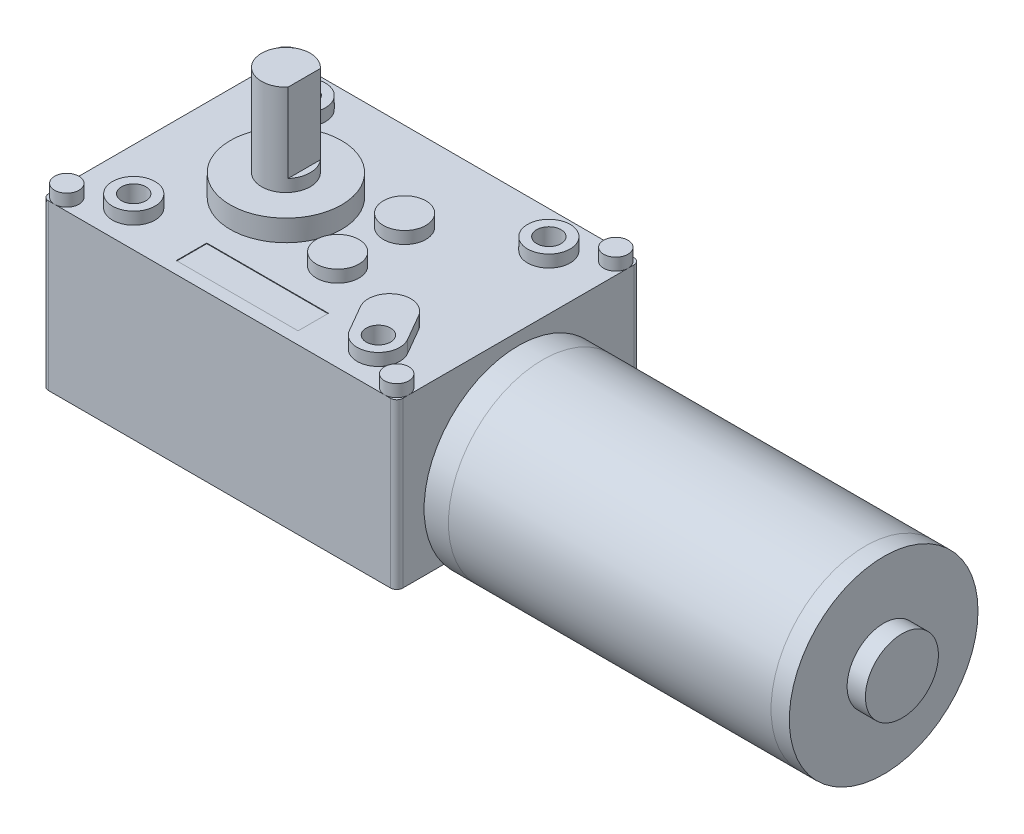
SolidWorks part; units mm, degrees
ref_plane "Front Plane" through (0, 0, 0) normal (0, 0, 1) x (1, 0, 0)
ref_plane "Top Plane" through (0, 0, 0) normal (0, 1, 0) x (1, 0, 0)
ref_plane "Right Plane" through (0, 0, 0) normal (1, 0, 0) x (0, 0, -1)
sketch "Sketch1" plane through (0, 0, 0) normal (0, 1, 0) x (1, 0, 0)
  line L1 (0, 0) -> (58.2, 0)
  line L2 (0, 0) -> (0, 40)
  line L3 (0, 40) -> (58.2, 40)
  line L4 (58.2, 0) -> (58.2, 40)
  dimension "D1" = 40
  dimension "D2" = 58.2
extrude "Boss-Extrude1" add sketch "Sketch1" along normal mid plane 27
sketch "Sketch2" plane through (0, 13.5, 0) normal (0, 1, 0) x (1, 0, 0)
  line L0 (58.2, 40) -> (0, 40) construction
  line L1 (0, 40) -> (0, 0) construction
  circle A0 centre (2, 38) radius 2
  circle A1 centre (56.2, 38) radius 2
  circle A2 centre (56.2, 2) radius 2
  circle A3 centre (2, 2) radius 2
  dimension "D1" = 4
  dimension "D2" = 2
  dimension "D3" = 2
  dimension "D6" = 2
  dimension "D7" = 2
  dimension "D4" = 2
  dimension "D5" = 2
extrude "Boss-Extrude2" add sketch "Sketch2" along normal blind 2
sketch "Sketch3" plane through (0, 0, 0) normal (0, 1, 0) x (1, 0, 0)
  line L0 (49.2, 6) -> (46.7, 10.3301) construction
  line L1 (49.2, 6) -> (47.3947, 6) construction
  line L2 (49.7311, 12.0801) -> (52.2311, 7.75)
  line L3 (43.6689, 8.5801) -> (46.1689, 4.25)
  line L4 (46.1689, 4.25) -> (52.2311, 7.75) construction
  circle A0 centre (9, 34) radius 3.5
  circle A1 centre (49.2, 34) radius 3.5
  arc A2 (46.1689, 4.25) -> (52.2311, 7.75) centre (49.2, 6) ccw
  circle A3 centre (9, 6) radius 3.5
  arc A4 (49.7311, 12.0801) -> (43.6689, 8.5801) centre (46.7, 10.3301) ccw
  circle A5 centre (34, 14.5) radius 3.5
  circle A6 centre (34, 25.5) radius 3.5
  point P8 (44.95, 13.3612)
  point P11 (50.95, 2.9689)
  point P17 (49.2, 6)
  dimension "D1" = 7
  dimension "D2" = 9
  dimension "D3" = 6
  dimension "D6" = 28
  dimension "D7" = 9
  dimension "D8" = 60
  dimension "D9" = 12
  dimension "D10" = 34
  dimension "D11" = 14.5
  dimension "D12" = 11
  dimension "D4" = 2
  dimension "D5" = 2
extrude "Boss-Extrude3" add sketch "Sketch3" along normal mid plane 31
sketch "Sketch4" plane through (0, 0, 0) normal (0, 1, 0) x (1, 0, 0)
  line L0 (0, 20) -> (20, 20) construction
  line L1 (0, 40) -> (0, 0) construction
  circle A0 centre (20, 20) radius 9.15
  dimension "D1" = 18.3
  dimension "D2" = 20
extrude "Boss-Extrude4" add sketch "Sketch4" along normal mid plane 34
sketch "Sketch5" plane through (0, 17, 0) normal (0, 1, 0) x (1, 0, 0)
  circle A0 centre (20, 20) radius 4
  dimension "D1" = 8
extrude "Boss-Extrude5" add sketch "Sketch5" along normal blind 2
sketch "Sketch6" plane through (0, 19, 0) normal (0, 1, 0) x (1, 0, 0)
  line L0 (20, 20) -> (23, 20) construction
  line L1 (23, 17.3542) -> (23, 22.6458)
  arc A0 (23, 22.6458) -> (23, 17.3542) centre (20, 20) ccw
  point P7 (23, 20)
  dimension "D1" = 8
  dimension "D2" = 3
extrude "Boss-Extrude6" add sketch "Sketch6" along normal blind 13
sketch "Sketch7" plane through (58.2, 0, 0) normal (1, 0, 0) x (0, 0, -1)
  line L0 (20, 13.5) -> (20, -4) construction
  line L1 (2, 13.5) -> (38, 13.5) construction
  circle A0 centre (20, -4) radius 15.5
  dimension "D2" = 31
  dimension "D1" = 17.5
extrude "Boss-Extrude7" add sketch "Sketch7" along normal blind 4 separate body
sketch "Sketch8" plane through (62.2, 0, 0) normal (1, 0, 0) x (0, 0, -1)
  circle A0 centre (20, -4) radius 15.5
  dimension "D1" = 31
extrude "Boss-Extrude8" add sketch "Sketch8" along normal blind 53 separate body
sketch "Sketch9" plane through (115.2, 0, 0) normal (1, 0, 0) x (0, 0, -1)
  circle A0 centre (20, -4) radius 15.5
  dimension "D1" = 31
extrude "Boss-Extrude9" add sketch "Sketch9" along normal blind 3 separate body
sketch "Sketch11" plane through (118.2, 0, 0) normal (1, 0, 0) x (0, 0, -1)
  circle A0 centre (20, -4) radius 6
  dimension "D1" = 12
extrude "Boss-Extrude10" add sketch "Sketch11" along normal blind 3
fillet "Fillet1" radius 1 4 edges at (0, 0, -40) (58.2, 0, -40) (58.2, 0, 0) (0, 0, 0)
sketch "Sketch12" plane through (0, 15.5, 0) normal (0, 1, 0) x (1, 0, 0)
  circle A0 centre (9, 6) radius 2
  circle A1 centre (9, 34) radius 2
  circle A2 centre (49.2, 34) radius 2
  circle A3 centre (49.2, 6) radius 2
  dimension "D1" = 4
extrude "Cut-Extrude1" cut sketch "Sketch12" against normal blind 3
sketch "Sketch13" plane through (0, -15.5, 0) normal (0, -1, 0) x (1, 0, 0)
  circle A0 centre (9, -6) radius 2
  circle A1 centre (9, -34) radius 2
  circle A2 centre (49.2, -6) radius 2
  circle A3 centre (49.2, -34) radius 2
  dimension "D1" = 4
extrude "Cut-Extrude2" cut sketch "Sketch13" against normal blind 3
sketch "Sketch14" plane through (0, 13.5, 0) normal (0, 1, 0) x (1, 0, 0)
  line L0 (0, 38) -> (0, 2) construction
  line L1 (20, 7) -> (40, 7)
  line L2 (20, 7) -> (20, 2)
  line L3 (20, 2) -> (40, 2)
  line L4 (40, 7) -> (40, 2)
  line L5 (2, 0) -> (56.2, 0) construction
  dimension "D1" = 20
  dimension "D2" = 5
  dimension "D3" = 20
  dimension "D4" = 2
extrude "Cut-Extrude3" cut sketch "Sketch14" against normal blind 0.1
sketch "Sketch15" plane through (0, -13.5, 0) normal (0, -1, 0) x (1, 0, 0)
  line L0 (1, 0) -> (57.2, 0) construction
  line L1 (20, -2) -> (40, -2)
  line L2 (20, -2) -> (20, -7)
  line L3 (20, -7) -> (40, -7)
  line L4 (40, -2) -> (40, -7)
  line L5 (0, -39) -> (0, -1) construction
  dimension "D1" = 20
  dimension "D2" = 5
  dimension "D3" = 2
  dimension "D4" = 20
extrude "Cut-Extrude4" cut sketch "Sketch15" against normal blind 0.1
